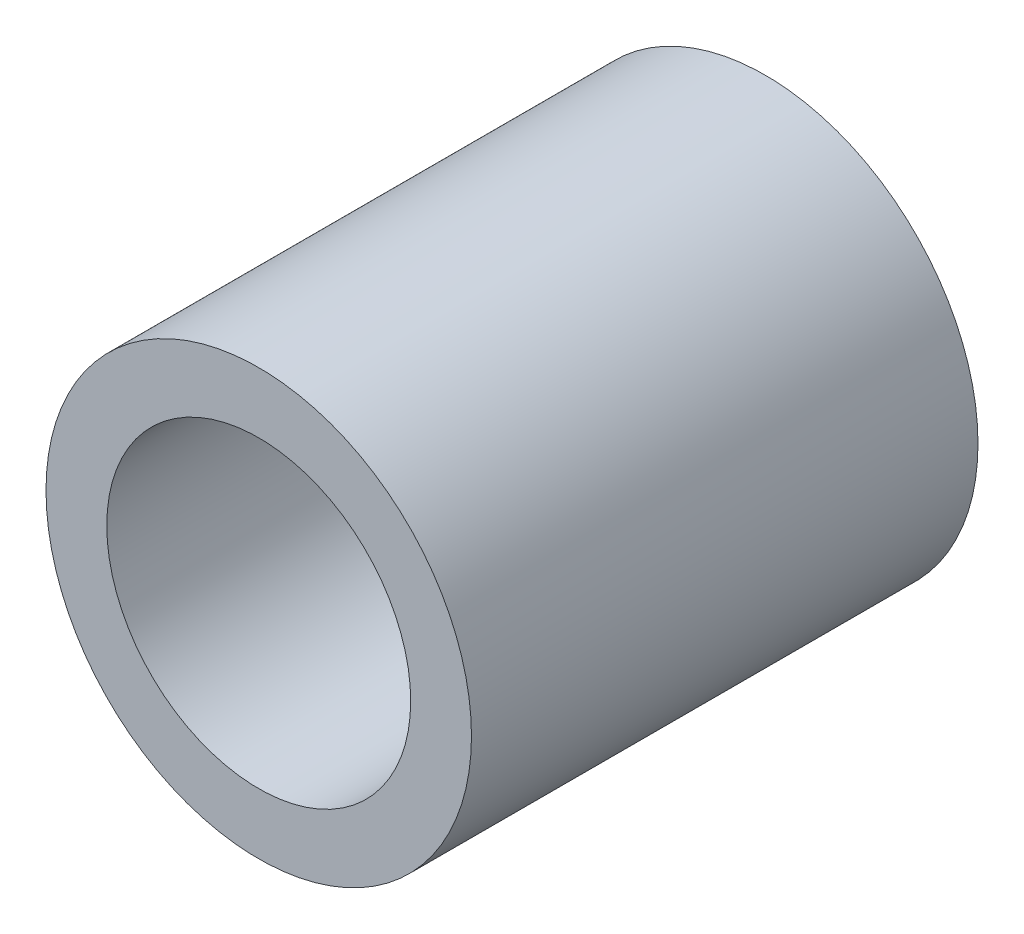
SolidWorks part; units mm, degrees
ref_plane "Front Plane" through (0, 0, 0) normal (0, 0, 1) x (1, 0, 0)
ref_plane "Top Plane" through (0, 0, 0) normal (0, 1, 0) x (1, 0, 0)
ref_plane "Right Plane" through (0, 0, 0) normal (1, 0, 0) x (0, 0, -1)
sketch "PipeSketch" plane through (0, 0, 0) normal (0, 0, 1) x (1, 0, 0)
  circle A0 centre (0, 0) radius 10.668
  circle A1 centre (0, 0) radius 7.62
  dimension "InnerDiameter" = 15.24
  dimension "OuterDiameter" = 21.336
extrude "Extrude1" add sketch "PipeSketch" along normal blind 25.4
sketch "FilterSketch" plane through (0, 0, 25.4) normal (0, 0, 1) x (1, 0, 0)
  circle A0 centre (0, 0) radius 6.35
  dimension "NominalDiameter" = 12.7
